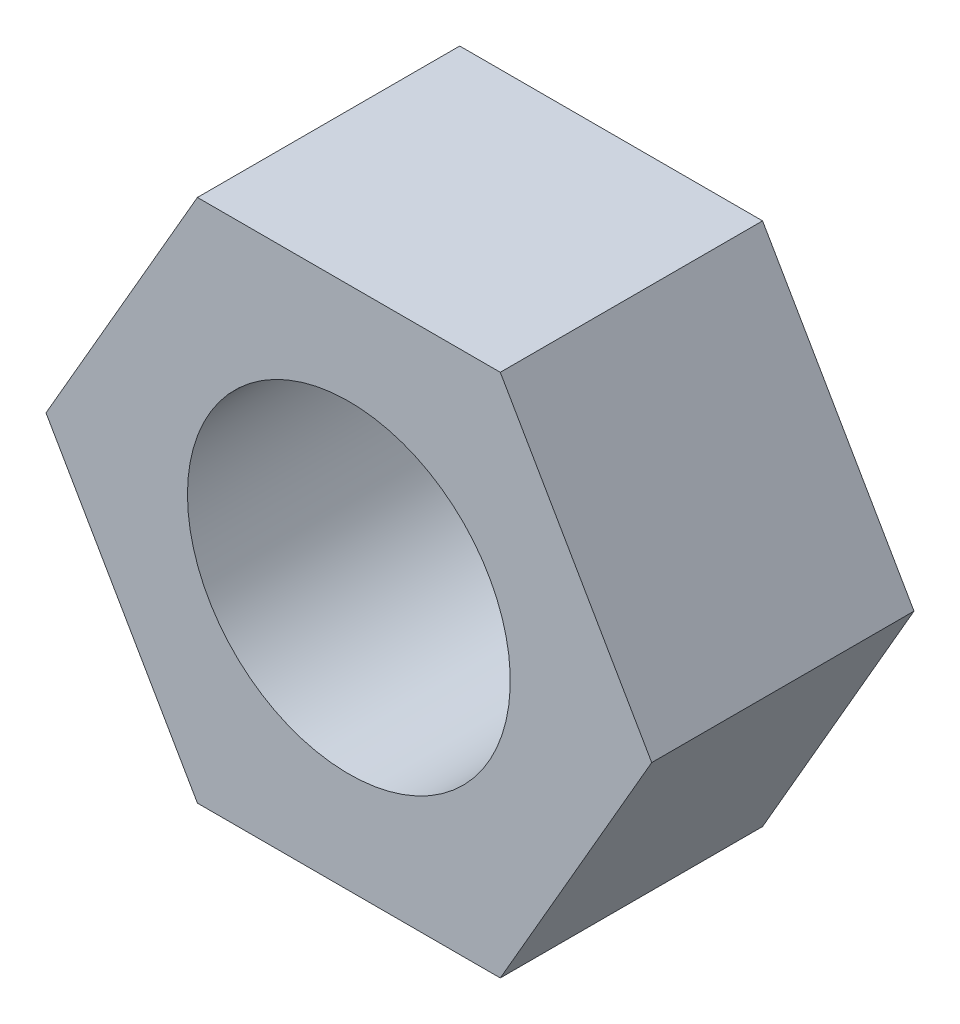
SolidWorks part; units mm, degrees
ref_plane "正面" through (0, 0, 0) normal (0, 0, 1) x (1, 0, 0)
ref_plane "平面" through (0, 0, 0) normal (0, 1, 0) x (1, 0, 0)
ref_plane "右側面" through (0, 0, 0) normal (1, 0, 0) x (0, 0, -1)
sketch "ｽｹｯﾁ1" plane through (0, 0, 0) normal (0, 0, 1) x (1, 0, 0)
  line L1 (3.7528, 6.5) -> (-3.7528, 6.5)
  line L2 (-3.7528, 6.5) -> (-7.5056, 0)
  line L3 (-7.5056, 0) -> (-3.7528, -6.5)
  line L4 (-3.7528, -6.5) -> (3.7528, -6.5)
  line L5 (3.7528, -6.5) -> (7.5056, 0)
  line L6 (7.5056, 0) -> (3.7528, 6.5)
  line L7 (17.7528, 3.7528) -> (25.2583, 3.7528)
  line L8 (17.7528, 3.7528) -> (17.7528, -3.7528)
  line L9 (17.7528, -3.7528) -> (25.2583, -3.7528)
  line L10 (25.2583, 3.7528) -> (25.2583, -3.7528)
  line L11 (14, 0) -> (21.5056, 0)
  line L12 (14, 0) -> (14, -7.5056)
  line L13 (14, -7.5056) -> (21.5056, -7.5056)
  line L14 (21.5056, 0) -> (21.5056, -7.5056)
  circle A0 centre (0, 0) radius 6.5 construction
  circle A1 centre (0, 0) radius 4
  circle A2 centre (0, 0) radius 11.5
  point P21 (21.5056, -3.7528)
  dimension "D1" = 13
  dimension "D2" = 8
  dimension "D3" = 23
extrude "ﾎﾞｽ - 押し出し1" add sketch "ｽｹｯﾁ1" along normal blind 6.5 contours L5 L6 L1 L2 L3 L4 A1
